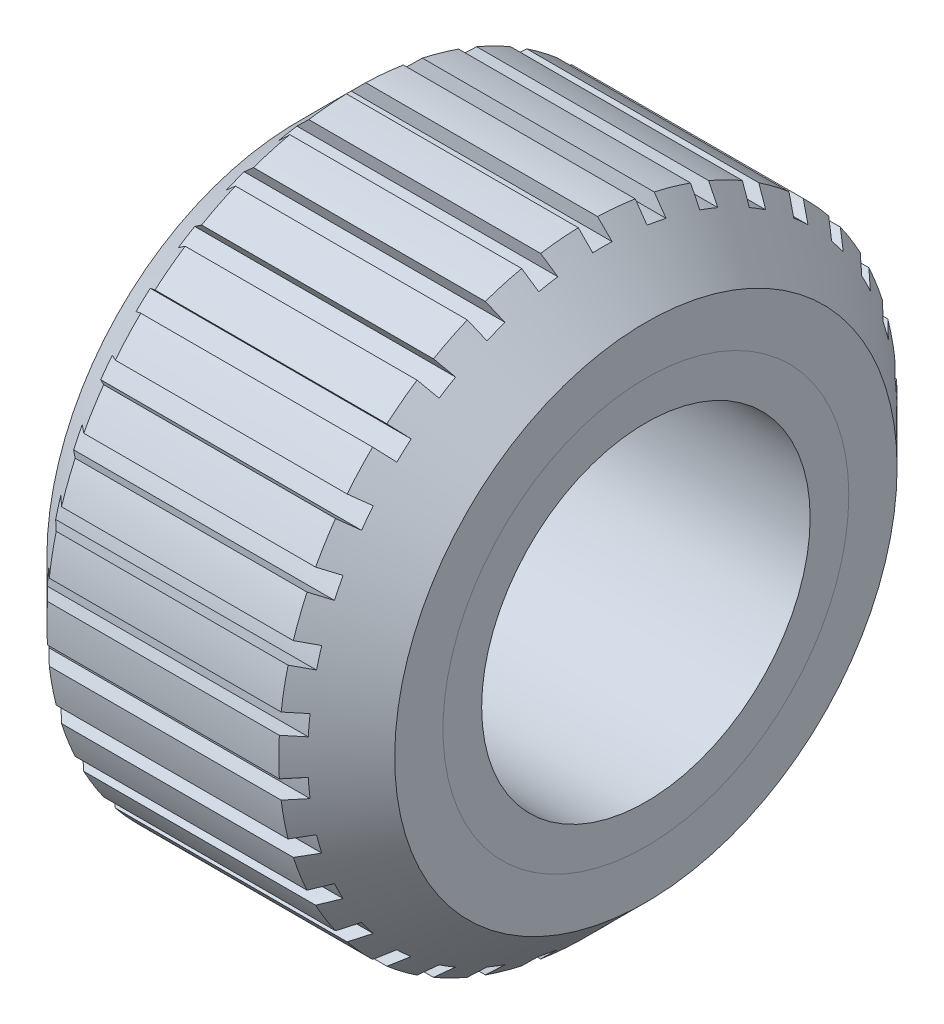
SolidWorks part; units mm, degrees
ref_plane "Front Plane" through (0, 0, 0) normal (0, 0, 1) x (1, 0, 0)
ref_plane "Top Plane" through (0, 0, 0) normal (0, 1, 0) x (1, 0, 0)
ref_plane "Right Plane" through (0, 0, 0) normal (1, 0, 0) x (0, 0, -1)
sketch "Sketch1" plane through (0, 0, 0) normal (1, 0, 0) x (0, 0, -1)
  circle A0 centre (0, 0) radius 16
  dimension "D1" = 32
extrude "Boss-Extrude1" add sketch "Sketch1" along normal blind 18
sketch "Sketch2" plane through (0, 0, 0) normal (-1, 0, 0) x (0, 0, 1)
  circle A0 centre (0, 0) radius 1.5
  dimension "D1" = 3
extrude "Cut-Extrude1" cut sketch "Sketch2" against normal blind 4
chamfer "Chamfer1" distance 3 angle 45 2 edges at (0, 0, -16) (18, 0, -16)
sketch "Sketch3" plane through (0, 0, 0) normal (1, 0, 0) x (0, 0, -1)
  line L0 (0, 0) -> (0, 16) construction
  line L1 (0.5, 15.2418) -> (0.5, 15.9922)
  line L2 (-0.5, 15.2418) -> (-0.5, 15.9922)
  line L3 (0.5, 0) -> (0.5, 19.2299) construction
  line L4 (0, 0) -> (0, 19.2299) construction
  line L5 (-0.5, 0) -> (-0.5, 19.2299) construction
  line L6 (2.3092, 15.0742) -> (2.4471, 15.8118)
  line L7 (3.2922, 14.8904) -> (3.43, 15.628)
  line L8 (5.0397, 14.3932) -> (5.3108, 15.0929)
  line L9 (5.9722, 14.0319) -> (6.2433, 14.7316)
  line L10 (7.5987, 13.2221) -> (7.9937, 13.86)
  line L11 (8.4489, 12.6956) -> (8.8439, 13.3336)
  line L12 (9.8988, 11.6007) -> (10.4044, 12.1552)
  line L13 (10.6378, 10.927) -> (11.1434, 11.4815)
  line L14 (11.8619, 9.5842) -> (12.4607, 10.0365)
  line L15 (12.4645, 8.7862) -> (13.0634, 9.2384)
  line L16 (13.421, 7.2414) -> (14.0927, 7.5759)
  line L17 (13.8668, 6.3463) -> (14.5385, 6.6807)
  line L18 (14.5231, 4.652) -> (15.2449, 4.8574)
  line L19 (14.7968, 3.6902) -> (15.5185, 3.8956)
  line L20 (15.1306, 1.9042) -> (15.8778, 1.9734)
  line L21 (15.2229, 0.9085) -> (15.9701, 0.9777)
  line L22 (15.2229, -0.9085) -> (15.9701, -0.9777)
  line L23 (15.1306, -1.9042) -> (15.8778, -1.9734)
  line L24 (14.7968, -3.6902) -> (15.5185, -3.8956)
  line L25 (14.5231, -4.652) -> (15.2449, -4.8574)
  line L26 (13.8668, -6.3463) -> (14.5385, -6.6807)
  line L27 (13.421, -7.2414) -> (14.0927, -7.5759)
  line L28 (12.4645, -8.7862) -> (13.0634, -9.2384)
  line L29 (11.8619, -9.5842) -> (12.4607, -10.0365)
  line L30 (10.6378, -10.927) -> (11.1434, -11.4815)
  line L31 (9.8988, -11.6007) -> (10.4044, -12.1552)
  line L32 (8.4489, -12.6956) -> (8.8439, -13.3336)
  line L33 (7.5987, -13.2221) -> (7.9937, -13.86)
  line L34 (5.9722, -14.0319) -> (6.2433, -14.7316)
  line L35 (5.0397, -14.3932) -> (5.3108, -15.0929)
  line L36 (3.2922, -14.8904) -> (3.43, -15.628)
  line L37 (2.3092, -15.0742) -> (2.4471, -15.8118)
  line L38 (0.5, -15.2418) -> (0.5, -15.9922)
  line L39 (-0.5, -15.2418) -> (-0.5, -15.9922)
  line L40 (-2.3092, -15.0742) -> (-2.4471, -15.8118)
  line L41 (-3.2922, -14.8904) -> (-3.43, -15.628)
  line L42 (-5.0397, -14.3932) -> (-5.3108, -15.0929)
  line L43 (-5.9722, -14.0319) -> (-6.2433, -14.7316)
  line L44 (-7.5987, -13.2221) -> (-7.9937, -13.86)
  line L45 (-8.4489, -12.6956) -> (-8.8439, -13.3336)
  line L46 (-9.8988, -11.6007) -> (-10.4044, -12.1552)
  line L47 (-10.6378, -10.927) -> (-11.1434, -11.4815)
  line L48 (-11.8619, -9.5842) -> (-12.4607, -10.0365)
  line L49 (-12.4645, -8.7862) -> (-13.0634, -9.2384)
  line L50 (-13.421, -7.2414) -> (-14.0927, -7.5759)
  line L51 (-13.8668, -6.3463) -> (-14.5385, -6.6807)
  line L52 (-14.5231, -4.652) -> (-15.2449, -4.8574)
  line L53 (-14.7968, -3.6902) -> (-15.5185, -3.8956)
  line L54 (-15.1306, -1.9042) -> (-15.8778, -1.9734)
  line L55 (-15.2229, -0.9085) -> (-15.9701, -0.9777)
  line L56 (-15.2229, 0.9085) -> (-15.9701, 0.9777)
  line L57 (-15.1306, 1.9042) -> (-15.8778, 1.9734)
  line L58 (-14.7968, 3.6902) -> (-15.5185, 3.8956)
  line L59 (-14.5231, 4.652) -> (-15.2449, 4.8574)
  line L60 (-13.8668, 6.3463) -> (-14.5385, 6.6807)
  line L61 (-13.421, 7.2414) -> (-14.0927, 7.5759)
  line L62 (-12.4645, 8.7862) -> (-13.0634, 9.2384)
  line L63 (-11.8619, 9.5842) -> (-12.4607, 10.0365)
  line L64 (-10.6378, 10.927) -> (-11.1434, 11.4815)
  line L65 (-9.8988, 11.6007) -> (-10.4044, 12.1552)
  line L66 (-8.4489, 12.6956) -> (-8.8439, 13.3336)
  line L67 (-7.5987, 13.2221) -> (-7.9937, 13.86)
  line L68 (-5.9722, 14.0319) -> (-6.2433, 14.7316)
  line L69 (-5.0397, 14.3932) -> (-5.3108, 15.0929)
  line L70 (-3.2922, 14.8904) -> (-3.43, 15.628)
  line L71 (-2.3092, 15.0742) -> (-2.4471, 15.8118)
  circle A0 centre (0, 0) radius 16 construction
  arc A1 (0.5, 15.9922) -> (-0.5, 15.9922) centre (0, 0) ccw
  arc A2 (0.5, 15.2418) -> (-0.5, 15.2418) centre (0, 0) ccw
  arc A3 (3.43, 15.628) -> (2.4471, 15.8118) centre (0, 0) ccw
  arc A4 (3.2922, 14.8904) -> (2.3092, 15.0742) centre (0, 0) ccw
  arc A5 (6.2433, 14.7316) -> (5.3108, 15.0929) centre (0, 0) ccw
  arc A6 (5.9722, 14.0319) -> (5.0397, 14.3932) centre (0, 0) ccw
  arc A7 (8.8439, 13.3336) -> (7.9937, 13.86) centre (0, 0) ccw
  arc A8 (8.4489, 12.6956) -> (7.5987, 13.2221) centre (0, 0) ccw
  arc A9 (11.1434, 11.4815) -> (10.4044, 12.1552) centre (0, 0) ccw
  arc A10 (10.6378, 10.927) -> (9.8988, 11.6007) centre (0, 0) ccw
  arc A11 (13.0634, 9.2384) -> (12.4607, 10.0365) centre (0, 0) ccw
  arc A12 (12.4645, 8.7862) -> (11.8619, 9.5842) centre (0, 0) ccw
  arc A13 (14.5385, 6.6807) -> (14.0927, 7.5759) centre (0, 0) ccw
  arc A14 (13.8668, 6.3463) -> (13.421, 7.2414) centre (0, 0) ccw
  arc A15 (15.5185, 3.8956) -> (15.2449, 4.8574) centre (0, 0) ccw
  arc A16 (14.7968, 3.6902) -> (14.5231, 4.652) centre (0, 0) ccw
  arc A17 (15.9701, 0.9777) -> (15.8778, 1.9734) centre (0, 0) ccw
  arc A18 (15.2229, 0.9085) -> (15.1306, 1.9042) centre (0, 0) ccw
  arc A19 (15.8778, -1.9734) -> (15.9701, -0.9777) centre (0, 0) ccw
  arc A20 (15.1306, -1.9042) -> (15.2229, -0.9085) centre (0, 0) ccw
  arc A21 (15.2449, -4.8574) -> (15.5185, -3.8956) centre (0, 0) ccw
  arc A22 (14.5231, -4.652) -> (14.7968, -3.6902) centre (0, 0) ccw
  arc A23 (14.0927, -7.5759) -> (14.5385, -6.6807) centre (0, 0) ccw
  arc A24 (13.421, -7.2414) -> (13.8668, -6.3463) centre (0, 0) ccw
  arc A25 (12.4607, -10.0365) -> (13.0634, -9.2384) centre (0, 0) ccw
  arc A26 (11.8619, -9.5842) -> (12.4645, -8.7862) centre (0, 0) ccw
  arc A27 (10.4044, -12.1552) -> (11.1434, -11.4815) centre (0, 0) ccw
  arc A28 (9.8988, -11.6007) -> (10.6378, -10.927) centre (0, 0) ccw
  arc A29 (7.9937, -13.86) -> (8.8439, -13.3336) centre (0, 0) ccw
  arc A30 (7.5987, -13.2221) -> (8.4489, -12.6956) centre (0, 0) ccw
  arc A31 (5.3108, -15.0929) -> (6.2433, -14.7316) centre (0, 0) ccw
  arc A32 (5.0397, -14.3932) -> (5.9722, -14.0319) centre (0, 0) ccw
  arc A33 (2.4471, -15.8118) -> (3.43, -15.628) centre (0, 0) ccw
  arc A34 (2.3092, -15.0742) -> (3.2922, -14.8904) centre (0, 0) ccw
  arc A35 (-0.5, -15.9922) -> (0.5, -15.9922) centre (0, 0) ccw
  arc A36 (-0.5, -15.2418) -> (0.5, -15.2418) centre (0, 0) ccw
  arc A37 (-3.43, -15.628) -> (-2.4471, -15.8118) centre (0, 0) ccw
  arc A38 (-3.2922, -14.8904) -> (-2.3092, -15.0742) centre (0, 0) ccw
  arc A39 (-6.2433, -14.7316) -> (-5.3108, -15.0929) centre (0, 0) ccw
  arc A40 (-5.9722, -14.0319) -> (-5.0397, -14.3932) centre (0, 0) ccw
  arc A41 (-8.8439, -13.3336) -> (-7.9937, -13.86) centre (0, 0) ccw
  arc A42 (-8.4489, -12.6956) -> (-7.5987, -13.2221) centre (0, 0) ccw
  arc A43 (-11.1434, -11.4815) -> (-10.4044, -12.1552) centre (0, 0) ccw
  arc A44 (-10.6378, -10.927) -> (-9.8988, -11.6007) centre (0, 0) ccw
  arc A45 (-13.0634, -9.2384) -> (-12.4607, -10.0365) centre (0, 0) ccw
  arc A46 (-12.4645, -8.7862) -> (-11.8619, -9.5842) centre (0, 0) ccw
  arc A47 (-14.5385, -6.6807) -> (-14.0927, -7.5759) centre (0, 0) ccw
  arc A48 (-13.8668, -6.3463) -> (-13.421, -7.2414) centre (0, 0) ccw
  arc A49 (-15.5185, -3.8956) -> (-15.2449, -4.8574) centre (0, 0) ccw
  arc A50 (-14.7968, -3.6902) -> (-14.5231, -4.652) centre (0, 0) ccw
  arc A51 (-15.9701, -0.9777) -> (-15.8778, -1.9734) centre (0, 0) ccw
  arc A52 (-15.2229, -0.9085) -> (-15.1306, -1.9042) centre (0, 0) ccw
  arc A53 (-15.8778, 1.9734) -> (-15.9701, 0.9777) centre (0, 0) ccw
  arc A54 (-15.1306, 1.9042) -> (-15.2229, 0.9085) centre (0, 0) ccw
  arc A55 (-15.2449, 4.8574) -> (-15.5185, 3.8956) centre (0, 0) ccw
  arc A56 (-14.5231, 4.652) -> (-14.7968, 3.6902) centre (0, 0) ccw
  arc A57 (-14.0927, 7.5759) -> (-14.5385, 6.6807) centre (0, 0) ccw
  arc A58 (-13.421, 7.2414) -> (-13.8668, 6.3463) centre (0, 0) ccw
  arc A59 (-12.4607, 10.0365) -> (-13.0634, 9.2384) centre (0, 0) ccw
  arc A60 (-11.8619, 9.5842) -> (-12.4645, 8.7862) centre (0, 0) ccw
  arc A61 (-10.4044, 12.1552) -> (-11.1434, 11.4815) centre (0, 0) ccw
  arc A62 (-9.8988, 11.6007) -> (-10.6378, 10.927) centre (0, 0) ccw
  arc A63 (-7.9937, 13.86) -> (-8.8439, 13.3336) centre (0, 0) ccw
  arc A64 (-7.5987, 13.2221) -> (-8.4489, 12.6956) centre (0, 0) ccw
  arc A65 (-5.3108, 15.0929) -> (-6.2433, 14.7316) centre (0, 0) ccw
  arc A66 (-5.0397, 14.3932) -> (-5.9722, 14.0319) centre (0, 0) ccw
  arc A67 (-2.4471, 15.8118) -> (-3.43, 15.628) centre (0, 0) ccw
  arc A68 (-2.3092, 15.0742) -> (-3.2922, 14.8904) centre (0, 0) ccw
  point P149 (0, 0)
  dimension "D3" = 30.5
  dimension "D1" = 0.5
  dimension "D2" = 0.5
  dimension "D4" = 34
extrude "Cut-Extrude2" cut sketch "Sketch3" along normal through all
sketch "Sketch4" plane through (18, 0, 0) normal (1, 0, 0) x (0, 0, -1)
  circle A0 centre (0, 0) radius 8.5
  dimension "D1" = 17
extrude "Cut-Extrude3" cut sketch "Sketch4" against normal blind 13
sketch "Sketch5" plane through (5, 0, 0) normal (1, 0, 0) x (0, 0, -1)
  line L0 (0, 0) -> (0, 8.5) construction
  line L1 (1, 4.899) -> (1, 8.441)
  line L2 (-1, 4.899) -> (-1, 8.441)
  line L3 (1, 0) -> (1, 8.5) construction
  line L4 (-1, 0) -> (-1, 8.5) construction
  line L5 (0, 0) -> (8.5, 0) construction
  line L6 (4.899, -1) -> (8.441, -1)
  line L7 (4.899, 1) -> (8.441, 1)
  line L8 (0, 0) -> (0, -8.5) construction
  line L9 (-1, -4.899) -> (-1, -8.441)
  line L10 (1, -4.899) -> (1, -8.441)
  line L11 (0, 0) -> (-8.5, 0) construction
  line L12 (-4.899, 1) -> (-8.441, 1)
  line L13 (-4.899, -1) -> (-8.441, -1)
  arc A0 (-4.899, -1) -> (-1, -4.899) centre (0, 0) ccw
  circle A1 centre (0, 0) radius 8.5 construction
  circle A2 centre (0, 0) radius 8.5 construction
  arc A3 (-8.441, -1) -> (-1, -8.441) centre (0, 0) ccw
  arc A4 (-1, 8.441) -> (-8.441, 1) centre (0, 0) ccw
  arc A5 (-1, 4.899) -> (-4.899, 1) centre (0, 0) ccw
  arc A6 (4.899, 1) -> (1, 4.899) centre (0, 0) ccw
  arc A7 (8.441, 1) -> (1, 8.441) centre (0, 0) ccw
  arc A8 (1, -8.441) -> (8.441, -1) centre (0, 0) ccw
  arc A9 (1, -4.899) -> (4.899, -1) centre (0, 0) ccw
  point P35 (0, 0)
  dimension "D3" = 10
  dimension "D1" = 1
  dimension "D2" = 1
  dimension "D4" = 4
extrude "Cut-Extrude4" cut sketch "Sketch5" against normal through all
sketch "Sketch6" plane through (18, 0, 0) normal (1, 0, 0) x (0, 0, -1)
  circle A0 centre (0, 0) radius 10.5
  dimension "D1" = 21
